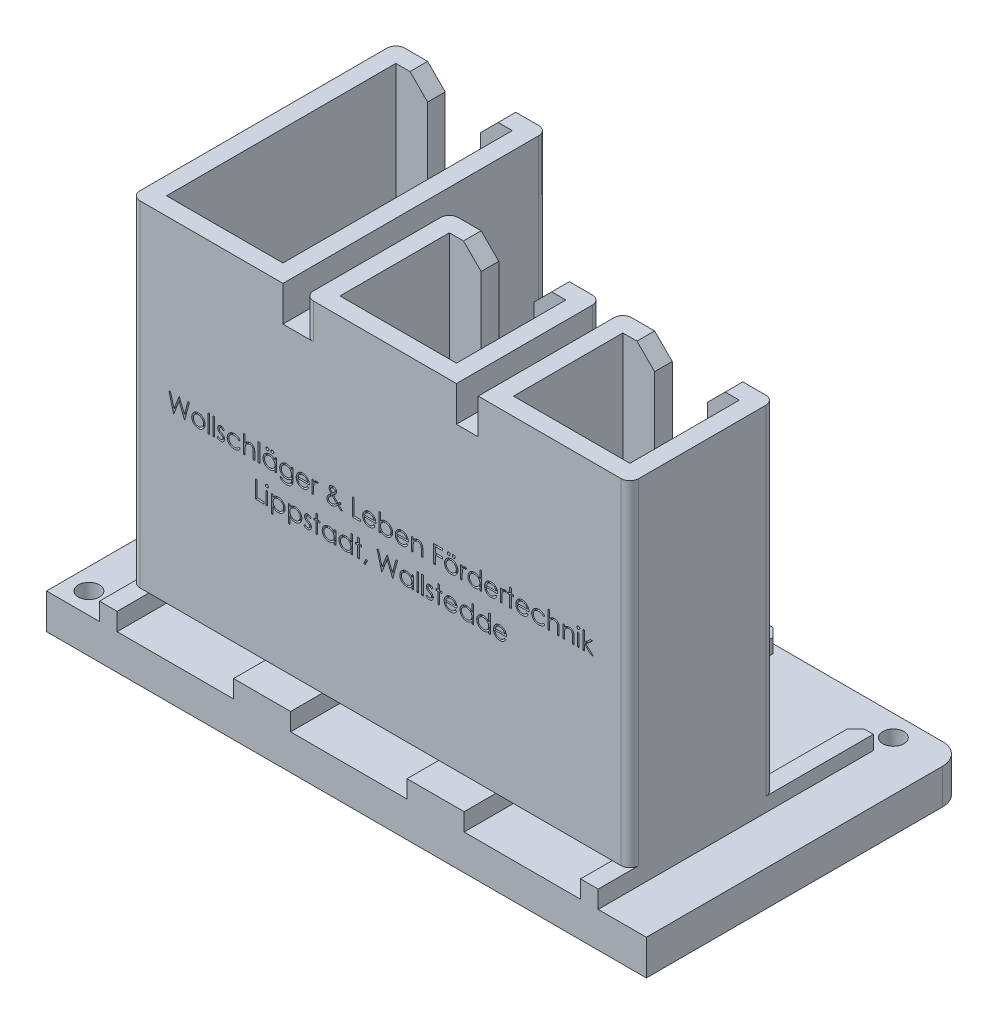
SolidWorks part; units mm, degrees
ref_plane "Ebene vorne" through (0, 0, 0) normal (0, 0, 1) x (1, 0, 0)
ref_plane "Ebene oben" through (0, 0, 0) normal (0, 1, 0) x (1, 0, 0)
ref_plane "Ebene rechts" through (0, 0, 0) normal (1, 0, 0) x (0, 0, -1)
sketch "Skizze1" plane through (0, 0, 0) normal (0, 1, 0) x (1, 0, 0)
  line L0 (0, 0) -> (-85, 0) construction
  line L1 (-85, -45) -> (85, -45)
  line L2 (-85, -45) -> (-85, 45)
  line L3 (-85, 45) -> (85, 45)
  line L4 (85, -45) -> (85, 45)
  line L5 (-85, -45) -> (85, 45) construction
  line L6 (-85, 45) -> (85, -45) construction
  line L7 (-79, 39) -> (71, 39) construction
  circle A0 centre (-79, 39) radius 3
  circle A1 centre (-79, -39) radius 3
  circle A2 centre (71, 39) radius 3
  point P0 (0, 0)
  dimension "D3" = 6
  dimension "D1" = 170
  dimension "D2" = 90
  dimension "D4" = 6
  dimension "D5" = 6
  dimension "D7" = 150
  dimension "D6" = 2
extrude "Grundplatte" add sketch "Skizze1" along normal blind 10
sketch "Skizze2" plane through (0, 10, 0) normal (0, 1, 0) x (1, 0, 0)
  line L0 (-85, -45) -> (85, -45) construction
  line L1 (-65, -45) -> (-32, -45)
  line L2 (-65, -45) -> (-65, 34)
  line L3 (-65, 34) -> (-32, 34)
  line L4 (-32, -45) -> (-32, 34)
  line L5 (-85, 45) -> (-85, -45) construction
  line L6 (-15.83, -45) -> (17.17, -45)
  line L7 (-15.83, -45) -> (-15.83, 0)
  line L8 (-15.83, 0) -> (17.17, 0)
  line L9 (17.17, -45) -> (17.17, 0)
  line L10 (33.34, -45) -> (66.34, -45)
  line L11 (33.34, -45) -> (33.34, 0)
  line L12 (33.34, 0) -> (66.34, 0)
  line L13 (66.34, -45) -> (66.34, 0)
  line L14 (-70, -45) -> (-70, 39)
  line L15 (-70, 39) -> (-32, 39)
  line L16 (-15.83, 5) -> (17.17, 5)
  line L17 (33.34, 5) -> (71.34, 5)
  line L18 (71.34, -45) -> (71.34, 5)
  line L19 (-32, 39) -> (-27, 39)
  line L20 (-27, 39) -> (-27, 5)
  line L21 (-27, 5) -> (-15.83, 5)
  line L22 (17.17, 5) -> (33.34, 5)
  dimension "D1" = 33
  dimension "D2" = 33
  dimension "D3" = 33
  dimension "D4" = 49.17
  dimension "D5" = 49.17
  dimension "D6" = 20
  dimension "D7" = 79
  dimension "D8" = 45
  dimension "D10" = 5
  dimension "D9" = 5
extrude "Magazine" add sketch "Skizze2" along normal blind 100 contours L22 L16 L21 L20 L19 L15 L14 L2 L3 L4 L7 L8 L9 L11 L12 L13 L18 L17
sketch "Skizze3" plane through (-65, 0, 0) normal (1, 0, 0) x (0, 0, -1)
  line L0 (-45, 110) -> (34, 110) construction
  line L1 (-31, 110) -> (-36, 110)
  line L2 (-31, 110) -> (-31, 15)
  line L3 (-31, 15) -> (-36, 15)
  line L4 (-36, 110) -> (-36, 15)
  line L5 (-45, 110) -> (-45, 10) construction
  line L6 (-45, 10) -> (34, 10) construction
  line L7 (-36, 15) -> (-45, 15)
  dimension "D1" = 14
  dimension "D2" = 5
  dimension "D3" = 5
extrude "Vorderseite" add sketch "Skizze3" along normal up to surface (136.34 mm away) contours L4 L3 L2 M6
sketch "Skizze5" plane through (-65, 0, 0) normal (1, 0, 0) x (0, 0, -1)
  line L0 (-36, 15) -> (-45, 15)
  line L1 (-36, 15) -> (-36, 110)
  line L2 (-36, 110) -> (-45, 110)
  line L3 (-45, 110) -> (-45, 15)
extrude "Trimmen" cut sketch "Skizze5" along normal through all both and the other way through all
sketch "Skizze8" plane through (0, 0, -34) normal (0, 0, 1) x (1, 0, 0)
  line L0 (-65, 110) -> (-65, 10) construction
  line L1 (-65, 14) -> (-32, 14)
  line L2 (-65, 14) -> (-65, 10)
  line L3 (-65, 10) -> (-32, 10)
  line L4 (-32, 14) -> (-32, 10)
  dimension "D1" = 4
extrude "Schieber" cut sketch "Skizze8" against normal up to surface and the other way up to surface contours L2 L1 L4 L3
sketch "Skizze9" plane through (0, 0, -39) normal (0, 0, -1) x (-1, 0, 0)
  line L0 (48.5, 110) -> (48.5, 34) construction
  line L1 (70, 110) -> (27, 110) construction
  line L2 (56, 110) -> (56, 34)
  line L3 (41, 110) -> (41, 34)
  line L4 (65, 14) -> (32, 14) construction
  arc A0 (56, 110) -> (41, 110) centre (48.5, 110) ccw
  arc A1 (41, 34) -> (56, 34) centre (48.5, 34) ccw
  point P4 (48.5, 72)
  dimension "D1" = 15
  dimension "D2" = 20
extrude "Eingriff" cut sketch "Skizze9" against normal up to next
pattern_linear "Lineares Muster1" count 3 spacing 49.17 along (1, 0, 0) of "Schieber", "Eingriff"
sketch "Skizze10" plane through (0, 110, 0) normal (0, 1, 0) x (1, 0, 0)
  line L0 (33.34, -36) -> (17.17, -36) construction
  line L1 (28.34, -36) -> (22.17, -36)
  line L2 (28.34, -36) -> (28.34, 5)
  line L3 (28.34, 5) -> (22.17, 5)
  line L4 (22.17, -36) -> (22.17, 5)
  line L5 (17.17, 5) -> (33.34, 5) construction
  line L6 (33.34, -45) -> (33.34, 5) construction
  line L7 (17.17, -31) -> (17.17, 0) construction
  line L8 (-20.83, -36) -> (-20.83, 5)
  line L9 (-20.83, -36) -> (-27, -36)
  line L10 (-27, -36) -> (-27, 5)
  line L11 (-20.83, 5) -> (-27, 5)
  line L12 (28.34, -36) -> (-20.83, -36) construction
  dimension "D1" = 5
  dimension "D2" = 5
  dimension "D4" = 49.17
  dimension "D3" = 2
extrude "Schnitt-Linear austragen4" cut sketch "Skizze10" against normal blind 10
chamfer "Fase1" distance 5 angle 45 6 edges at (-41, 110, -36.5) (-56, 110, -36.5) (-6.83, 110, -2.5) (8.17, 110, -2.5) (42.34, 110, -2.5) (57.34, 110, -2.5)
sketch "Skizze12" plane through (0, 0, -5) normal (0, 0, -1) x (-1, 0, 0)
  line L1 (-33.34, 14) -> (-17.17, 14)
  line L2 (-33.34, 14) -> (-33.34, 10)
  line L3 (-33.34, 10) -> (-17.17, 10)
  line L4 (-17.17, 14) -> (-17.17, 10)
  line L5 (15.83, 14) -> (27, 14)
  line L6 (15.83, 14) -> (15.83, 10)
  line L7 (15.83, 10) -> (27, 10)
  line L8 (27, 14) -> (27, 10)
extrude "Aufsatz-Linear austragen4" add sketch "Skizze12" along normal up to surface (40 mm away) contours L2 L1 L4 L3 | L6 L5 L8 L7
sketch "Skizze13" plane through (0, 0, -39) normal (0, 0, -1) x (-1, 0, 0)
  line L1 (27, 14) -> (32, 14)
  line L2 (27, 14) -> (27, 10)
  line L3 (27, 10) -> (32, 10)
  line L4 (32, 14) -> (32, 10)
  line L5 (65, 14) -> (70, 14)
  line L6 (65, 14) -> (65, 10)
  line L7 (65, 10) -> (70, 10)
  line L8 (70, 14) -> (70, 10)
extrude "Aufsatz-Linear austragen5" add sketch "Skizze13" along normal up to surface (6 mm away) contours L2 L1 L4 L3 | L6 L5 L8 L7
sketch "Skizze14" plane through (0, 0, -5) normal (0, 0, -1) x (-1, 0, 0)
  line L1 (-66.34, 14) -> (-71.34, 14)
  line L2 (-66.34, 14) -> (-66.34, 10)
  line L3 (-66.34, 10) -> (-71.34, 10)
  line L4 (-71.34, 14) -> (-71.34, 10)
extrude "Aufsatz-Linear austragen6" add sketch "Skizze14" along normal offset from surface (28 mm away) 12
chamfer "Fase2" distance 2.5 angle 45 6 edges at (66.34, 12, -33) (-65, 12, -45) (-32, 12, -45) (-15.83, 12, -45) (17.17, 12, -45) (33.34, 12, -45)
fillet "Verrundung2" radius 6 2 edges at (-85, 5, -45) (85, 5, -45)
fillet "Verrundung1" radius 2.5 10 edges at (-70, 62, -39) (-27, 57, -5) (-27, 62, -39) (-70, 62.5, 36) (71.34, 62, -5) (71.34, 62.5, 36) (-20.83, 105, 36) (28.34, 105, -5) (-20.83, 105, -5) (22.17, 105, -5)
sketch "Skizze11" plane through (0, 0, 36) normal (0, 0, 1) x (1, 0, 0)
  line L0 (-70, 62.5) -> (71.34, 62.5) construction
  line L1 (-70, 15) -> (-70, 110) construction
  line L2 (71.34, 15) -> (71.34, 110) construction
  text T0 "Wollschläger & Leben Fördertechnik  Lippstadt, Wallstedde" font "Century Gothic" height 5
extrude "Schnitt-Linear austragen5" cut sketch "Skizze11" against normal blind 1
sketch "Skizze15" plane through (0, 10, 0) normal (0, 1, 0) x (1, 0, 0)
  line L0 (-65, -31) -> (-32, 34) construction
  line L1 (17.17, -31) -> (-15.83, 0) construction
  line L2 (66.34, -31) -> (33.34, -1.25) construction
  line L3 (33.34, -45) -> (33.34, 42.5) construction
  circle A0 centre (49.84, -16.125) radius 10
  circle A1 centre (0.67, -15.5) radius 10
  circle A2 centre (-48.5, 1.5) radius 10
  dimension "D1" = 20
extrude "Schnitt-Linear austragen6" cut sketch "Skizze15" against normal up to next
chamfer "Fase3" distance 1 angle 45 3 edges at (-48.5, 10, 8.5) (0.67, 10, 25.5) (49.84, 10, 26.125)
